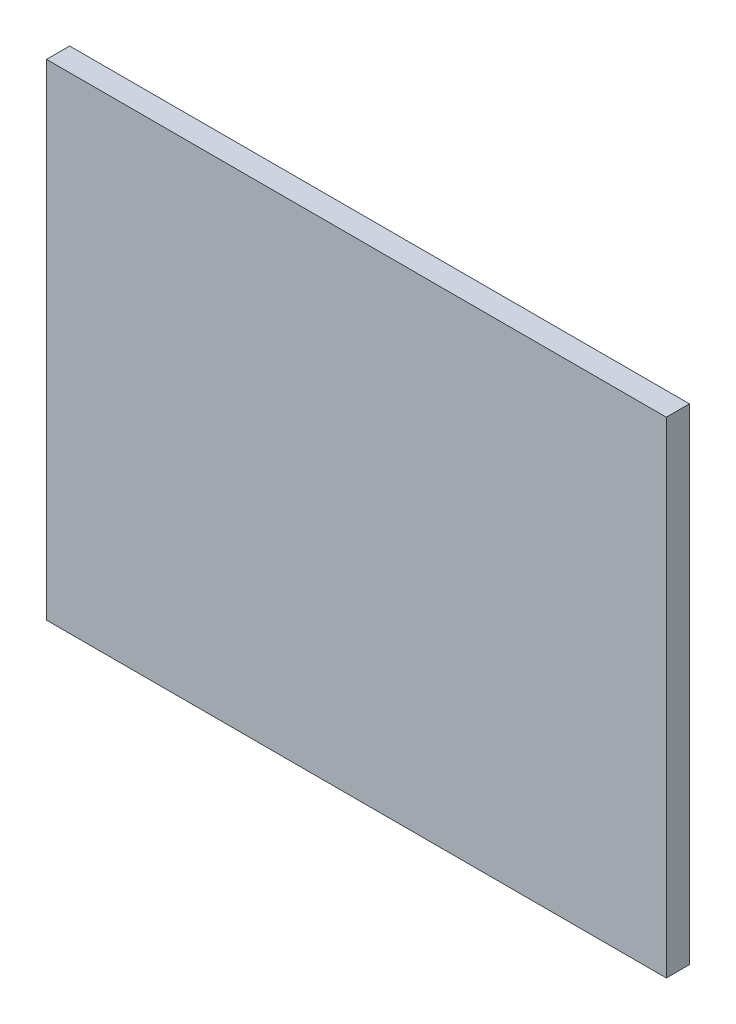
SolidWorks part; units mm, degrees
ref_plane "Front" through (0, 0, 0) normal (0, 0, 1) x (1, 0, 0)
ref_plane "Top" through (0, 0, 0) normal (0, 1, 0) x (1, 0, 0)
ref_plane "Right" through (0, 0, 0) normal (1, 0, 0) x (0, 0, -1)
sketch "Sketch1" plane through (0, 0, 0) normal (0, 0, 1) x (1, 0, 0)
  line L1 (-42.545, 66.675) -> (42.545, 66.675)
  line L2 (-42.545, 66.675) -> (-42.545, 0)
  line L3 (-42.545, 0) -> (42.545, 0)
  line L4 (42.545, 66.675) -> (42.545, 0)
  dimension "D1" = 66.675
  dimension "D2" = 85.09
extrude "Extrude1" add sketch "Sketch1" along normal blind 3.175
